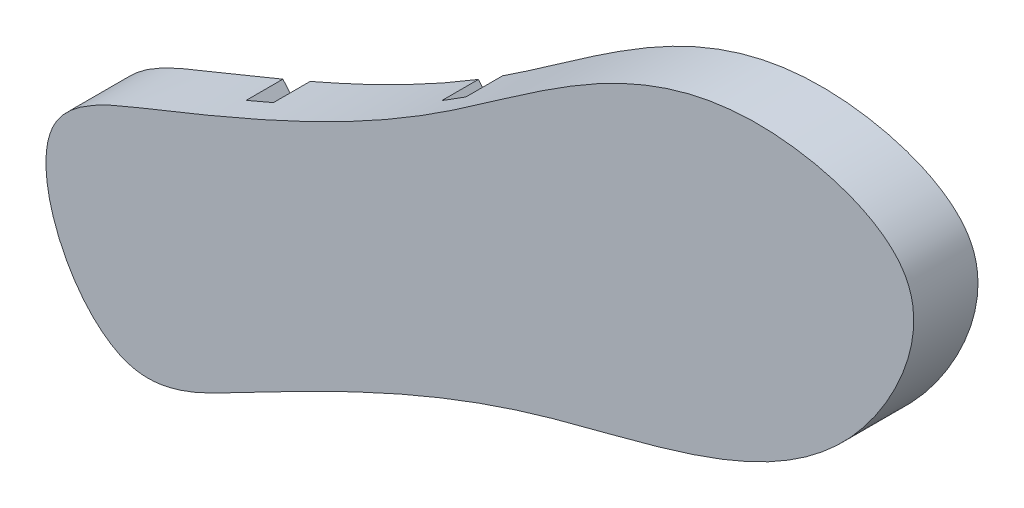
SolidWorks part; units mm, degrees
ref_plane "Alzado" through (0, 0, 0) normal (0, 0, 1) x (1, 0, 0)
ref_plane "Planta" through (0, 0, 0) normal (0, 1, 0) x (1, 0, 0)
ref_plane "Vista lateral" through (0, 0, 0) normal (1, 0, 0) x (0, 0, -1)
ref_plane "Plano_goma" through (0, 0, 12.5) normal (0, 0, 1) x (1, 0, 0)
sketch "Sk_Goma" plane through (0, 0, 0) normal (0, 0, 1) x (1, 0, 0)
  spline S0 degree 3 poles (434.3863, 332.3422) (428.9443, 344.1331) (441.1466, 348.8882) (453.6205, 354.2888) (465.9627, 365.6031) (480.5578, 360.8034) (474.7412, 346.583) (458.1239, 344.5314) (445.9213, 338.5429) (434.3863, 332.3422) (428.9443, 344.1331) (441.1466, 348.8882) knots -0.299528 -0.141321 -0.087871 0 0.05345 0.211657 0.387435 0.456064 0.524694 0.700472 0.858679 0.912129 1 1.05345 1.211657 1.387435 only from (431.735, 343.7767) to (431.735, 343.7767)
extrude "Goma" add sketch "Sk_Goma" along normal blind 3.5 from offset 12.5
sketch "Sk_Ranuras_agua" plane through (0, 0, 12.5) normal (0, 0, 1) x (1, 0, 0)
  line L0 (439.9765, 349.7832) -> (441.4292, 350.4537)
  line L1 (441.4292, 350.4537) -> (450.9278, 339.4185)
  line L2 (450.9278, 339.4185) -> (449.4751, 338.748)
  line L3 (449.4751, 338.748) -> (439.9765, 349.7832)
  line L4 (450.872, 354.8119) -> (452.3247, 355.4824)
  line L5 (452.3247, 355.4824) -> (461.8234, 344.4472)
  line L6 (461.8234, 344.4472) -> (460.3706, 343.7767)
  line L7 (460.3706, 343.7767) -> (450.872, 354.8119)
  line L8 (461.7675, 359.8406) -> (463.2202, 360.5111)
  line L9 (463.2202, 360.5111) -> (472.7189, 349.4759)
  line L10 (472.7189, 349.4759) -> (471.2661, 348.8054)
  line L11 (471.2661, 348.8054) -> (461.7675, 359.8406)
extrude "Ranuras_agua" cut sketch "Sk_Ranuras_agua" along normal blind 2
